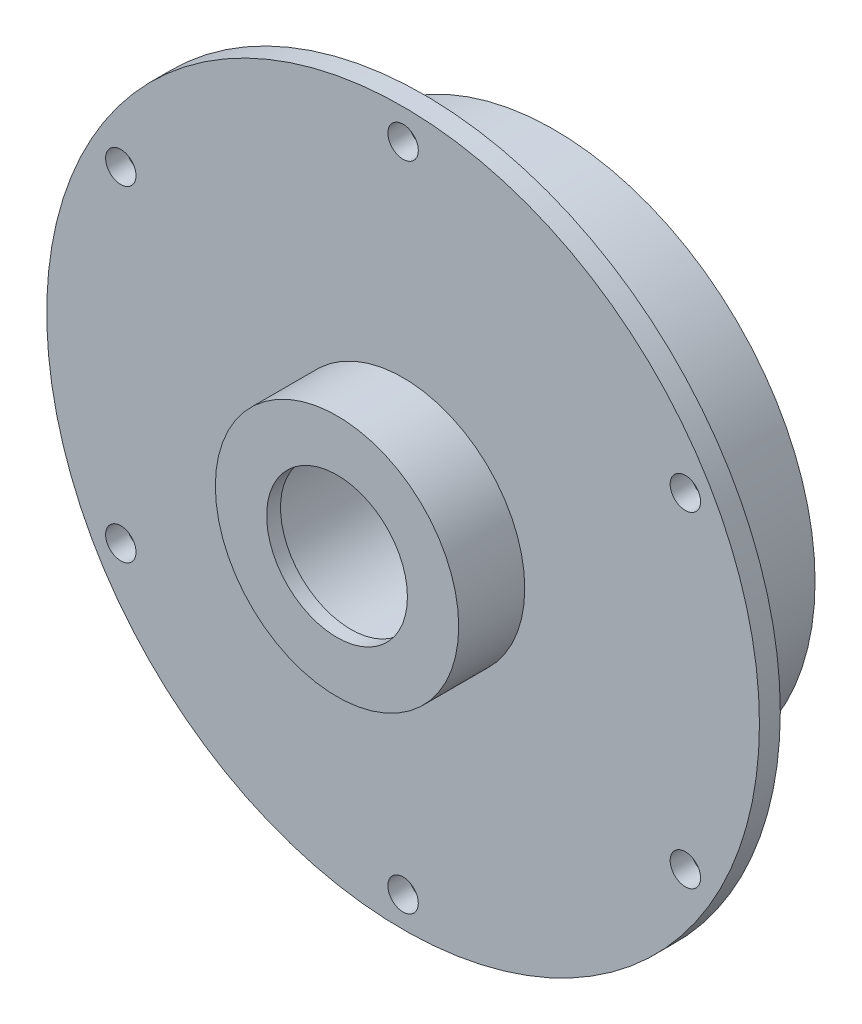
SolidWorks part; units mm, degrees
ref_plane "Front Plane" through (0, 0, 0) normal (0, 0, 1) x (1, 0, 0)
ref_plane "Top Plane" through (0, 0, 0) normal (0, 1, 0) x (1, 0, 0)
ref_plane "Right Plane" through (0, 0, 0) normal (1, 0, 0) x (0, 0, -1)
sketch "Sketch1" plane through (0, 0, 0) normal (1, 0, 0) x (0, 0, -1)
  line L0 (8, 40.5) -> (0, 40.5)
  line L1 (0, 40.5) -> (0, 70)
  line L2 (0, 70) -> (38, 70)
  line L3 (65, 70) -> (65, 50)
  line L4 (65, 50) -> (8, 50)
  line L5 (8, 50) -> (8, 40.5)
  line L6 (38, 70) -> (38, 205)
  line L7 (38, 205) -> (50, 205)
  line L8 (50, 205) -> (50, 150)
  line L9 (50, 150) -> (125, 150)
  line L10 (125, 150) -> (125, 110)
  line L11 (125, 110) -> (50, 110)
  line L12 (50, 110) -> (50, 70)
  line L13 (0, 0) -> (200.7353, 0) construction
  line L14 (50, 70) -> (65, 70)
  dimension "D1" = 29.5
  dimension "D2" = 65
  dimension "D3" = 20
  dimension "D4" = 57
  dimension "D5" = 38
  dimension "D6" = 12
  dimension "D7" = 135
  dimension "D8" = 55
  dimension "D9" = 40
  dimension "D10" = 75
  dimension "D11" = 40.5
revolve "Revolve1" add sketch "Sketch1" angle 360 about L13
hole_wizard "M16 Tapped Hole1" positions "Sketch2" profile "Sketch4" tap size "M16" standard "DIN"
sketch "Sketch2" plane through (0, 0, -125) normal (0, 0, -1) x (-1, 0, 0)
  line L0 (0, 0) -> (0, 130) construction
  point P0 (0, 130)
  dimension "D1" = 130
sketch "Sketch4" plane through (0, 130, -125) normal (1, 0, 0) x (0, 1, 0)
  line L0 (0, 0) -> (0, 52.206)
  line L1 (0, 52.206) -> (7, 48)
  line L2 (7, 48) -> (7, 0)
  line L5 (7, 0) -> (0, 0)
  line L10 (0, 52.206) -> (-7, 48) construction
  line L11 (0, -6.35) -> (0, 107.95) construction
  dimension "Tap Drill Dia." = 14
  dimension "Tap Drill Depth" = 48
  dimension "Drill Angle" = 118
pattern_circular "CirPattern1" count 6 over 360 about axis through (0, 0, 0) along (0, 0, 1) of "M16 Tapped Hole1"
hole_wizard "Ø17.5 (17.5) Diameter Hole2" positions "Sketch7" profile "Sketch8" hole size "Ø17.5" standard "DIN"
sketch "Sketch7" plane through (0, 0, -38) normal (0, 0, 1) x (1, 0, 0)
  line L0 (0, 187.5) -> (0, 0) construction
  circle A1 centre (0, 0) radius 187.5 construction
  point P0 (0, 187.5)
  dimension "D1" = 375
sketch "Sketch8" plane through (0, 187.5, -38) normal (1, 0, 0) x (0, -1, 0)
  line L0 (0, 0) -> (0, 31.2575)
  line L1 (0, 31.2575) -> (8.75, 26)
  line L2 (8.75, 26) -> (8.75, 0)
  line L5 (8.75, 0) -> (0, 0)
  line L10 (0, 31.2575) -> (-8.75, 26) construction
  line L11 (0, -6.35) -> (0, 107.95) construction
  dimension "Hole Dia." = 17.5
  dimension "Hole Depth" = 26
  dimension "Drill Angle" = 118
pattern_circular "CirPattern2" count 6 over 360 about axis through (0, 0, 0) along (0, 0, 1) of "Ø17.5 (17.5) Diameter Hole2"
hole_wizard "M8 Tapped Hole1" positions "Sketch9" profile "Sketch11" tap size "M8" standard "DIN"
sketch "Sketch9" plane through (0, 0, -65) normal (0, 0, -1) x (-1, 0, 0)
  line L0 (0, 0) -> (0, 60) construction
  point P0 (0, 60)
  dimension "D1" = 60
sketch "Sketch11" plane through (0, 60, -65) normal (1, 0, 0) x (0, 1, 0)
  line L0 (0, 0) -> (0, 27.0429)
  line L1 (0, 27.0429) -> (3.4, 25)
  line L2 (3.4, 25) -> (3.4, 0)
  line L5 (3.4, 0) -> (0, 0)
  line L10 (0, 27.0429) -> (-3.4, 25) construction
  line L11 (0, -6.35) -> (0, 107.95) construction
  dimension "Tap Drill Dia." = 6.8
  dimension "Tap Drill Depth" = 25
  dimension "Drill Angle" = 118
pattern_circular "CirPattern3" count 6 over 360 about axis through (0, 0, 0) along (0, 0, 1) of "M8 Tapped Hole1"
